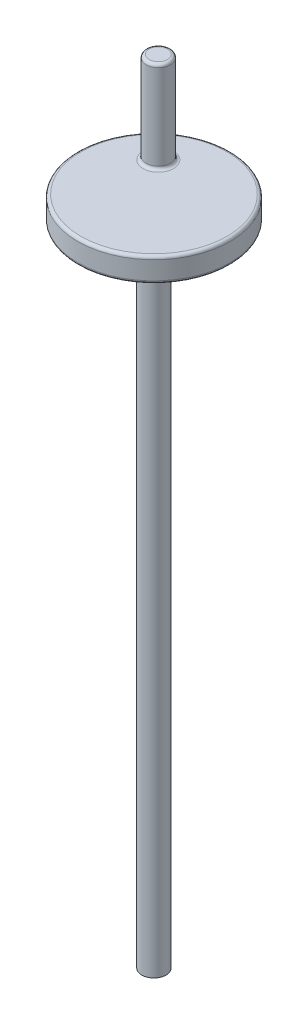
SolidWorks part; units mm, degrees
ref_plane "Front Plane" through (0, 0, 0) normal (0, 0, 1) x (1, 0, 0)
ref_plane "Top Plane" through (0, 0, 0) normal (0, 1, 0) x (1, 0, 0)
ref_plane "Right Plane" through (0, 0, 0) normal (1, 0, 0) x (0, 0, -1)
sketch "Sketch1" plane through (0, 0, 0) normal (0, 1, 0) x (1, 0, 0)
  circle A0 centre (0, 0) radius 4
extrude "Boss-Extrude1" add sketch "Sketch1" along normal blind 220
sketch "Sketch2" plane through (0, 220, 0) normal (0, 1, 0) x (1, 0, 0)
  circle A0 centre (0, 0) radius 25
extrude "Boss-Extrude2" add sketch "Sketch2" against normal blind 8
sketch "Sketch3" plane through (0, 220, 0) normal (0, 1, 0) x (1, 0, 0)
  circle A0 centre (-9.0274, 10.4682) radius 4
extrude "Boss-Extrude3" add sketch "Sketch3" along normal blind 30
fillet "Fillet1" radius 1 4 edges at (-9.0274, 250, -6.4682) (0, 212, 25) (0, 220, 25) (-9.0274, 220, -6.4682)
sketch "Sketch4" plane through (0, 220, 0) normal (0, 1, 0) x (1, 0, 0)
  line L0 (-4.4, 0) -> (4.4, 0) construction
  circle A0 centre (8, 0) radius 1
  dimension "D1" = 8
